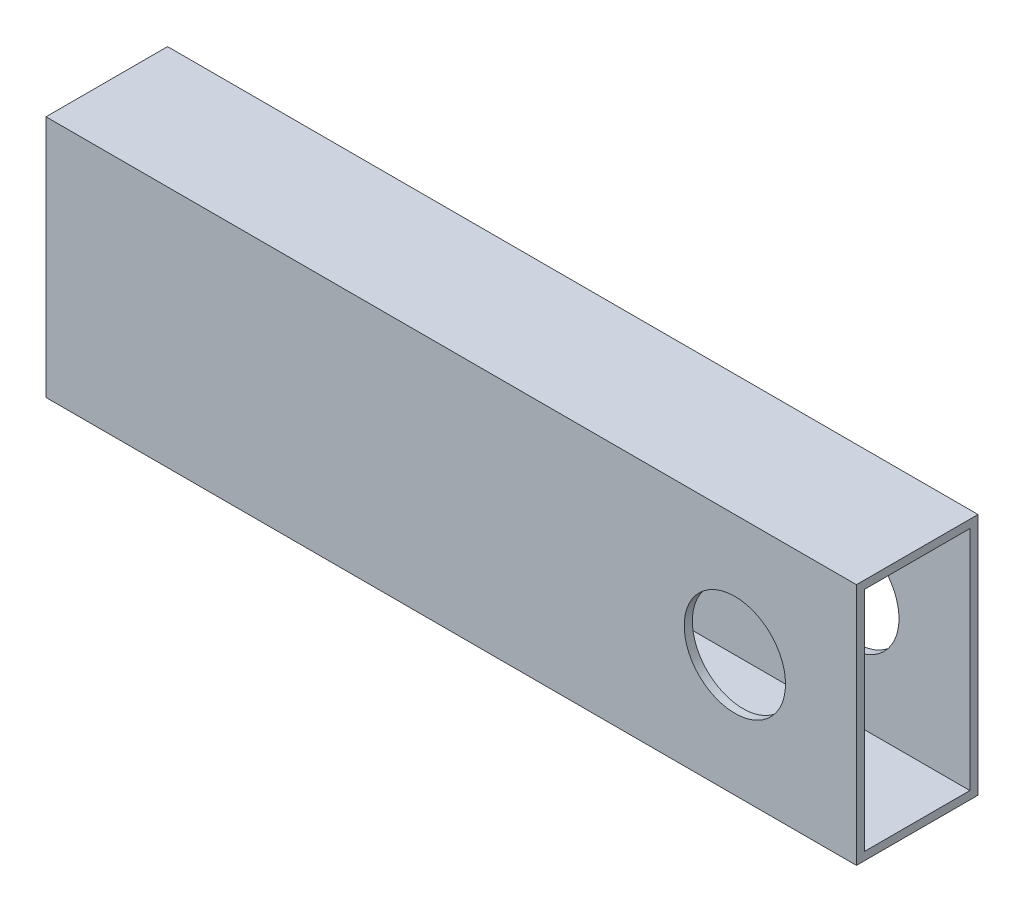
SolidWorks part; units mm, degrees
ref_plane "Face" through (0, 0, 0) normal (0, 0, 1) x (1, 0, 0)
ref_plane "Dessus" through (0, 0, 0) normal (0, 1, 0) x (1, 0, 0)
ref_plane "Droite" through (0, 0, 0) normal (1, 0, 0) x (0, 0, -1)
sketch "Esquisse1" plane through (0, 0, 0) normal (0, 0, 1) x (1, 0, 0)
  line L1 (0, 0) -> (200, 0)
  line L2 (0, 0) -> (0, 60)
  line L3 (0, 60) -> (200, 60)
  line L4 (200, 0) -> (200, 60)
  circle A0 centre (170, 30) radius 12.5
  dimension "D5" = 25
  dimension "D1" = 60
  dimension "D2" = 200
  dimension "D3" = 30
  dimension "D4" = 30
extrude "Extrusion1" add sketch "Esquisse1" along normal blind 30
sketch "Esquisse2" plane through (200, 0, 0) normal (1, 0, 0) x (0, 0, -1)
  line L8 (-2, 2) -> (-2, 58)
  line L9 (-2, 58) -> (-28, 58)
  line L10 (-28, 58) -> (-28, 2)
  line L11 (-28, 2) -> (-2, 2)
  line L12 (-2, 2) -> (-2, 58)
  line L13 (-2, 58) -> (-28, 58)
  line L14 (-28, 58) -> (-28, 2)
  line L15 (-28, 2) -> (-2, 2)
  dimension "D1" = 2
extrude "Enlèv. mat.-Extru.1" cut sketch "Esquisse2" against normal through all
equation "\"D3@Esquisse1\" = \"D1@Esquisse1\"/2"
